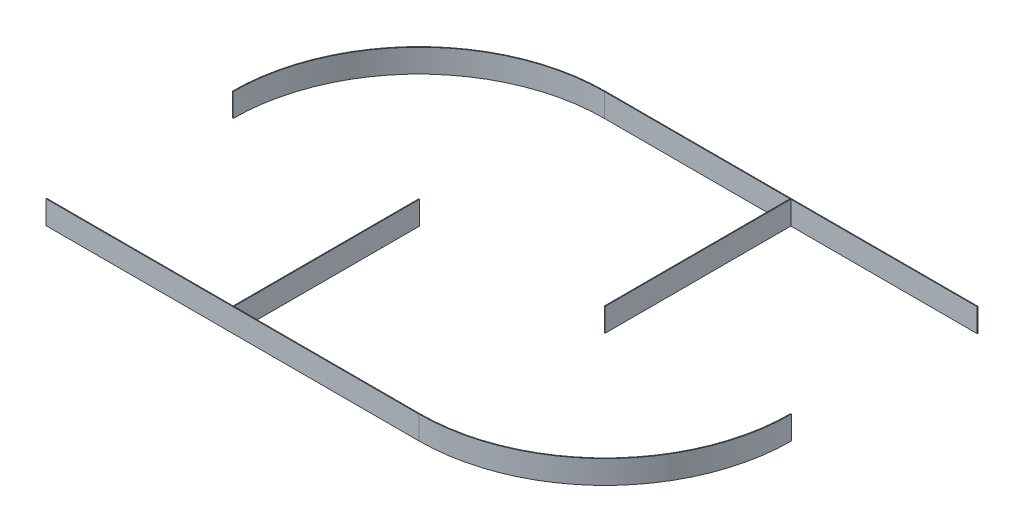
SolidWorks part; units mm, degrees
ref_plane "Front Plane" through (0, 0, 0) normal (0, 0, 1) x (1, 0, 0)
ref_plane "Top Plane" through (0, 0, 0) normal (0, 1, 0) x (1, 0, 0)
ref_plane "Right Plane" through (0, 0, 0) normal (1, 0, 0) x (0, 0, -1)
sketch "Sketch1" plane through (0, 0, 0) normal (0, 1, 0) x (1, 0, 0)
  line L0 (-304.8, 0) -> (304.8, 0) construction
  line L1 (304.8, -609.6) -> (-914.4, -609.6)
  line L2 (-304.8, 609.6) -> (914.4, 609.6)
  line L3 (304.8, 609.6) -> (304.8, 0)
  line L4 (-304.8, -609.6) -> (-304.8, 0)
  arc A0 (304.8, -609.6) -> (914.4, 0) centre (304.8, 0) ccw
  arc A1 (-304.8, 609.6) -> (-914.4, 0) centre (-304.8, 0) ccw
  point P4 (0, 0)
  dimension "D2" = 609.6
  dimension "D3" = 609.6
  dimension "D1" = 609.6
  dimension "D4" = 1219.2
  dimension "D5" = 1219.2
extrude "Extrude-Thin1" add sketch "Sketch1" along normal blind 76.2 thin
